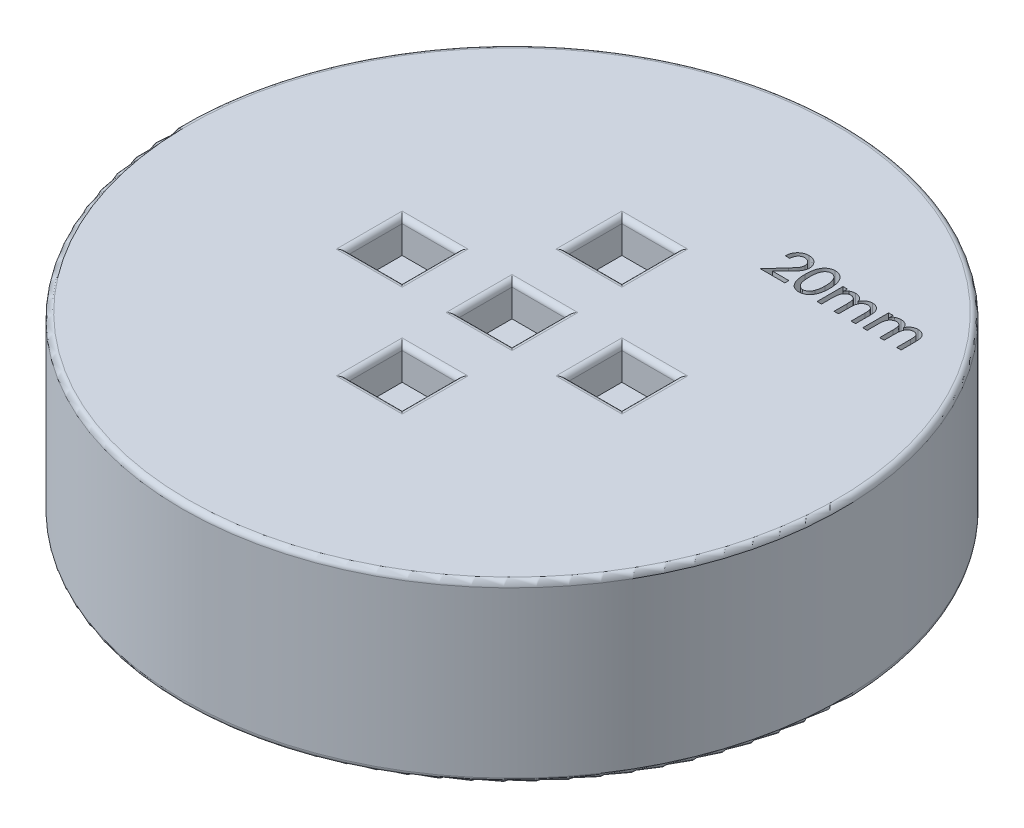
SolidWorks part; units mm, degrees
ref_plane "Front Plane" through (0, 0, 0) normal (0, 0, 1) x (1, 0, 0)
ref_plane "Top Plane" through (0, 0, 0) normal (0, 1, 0) x (1, 0, 0)
ref_plane "Right Plane" through (0, 0, 0) normal (1, 0, 0) x (0, 0, -1)
sketch "Sketch1" plane through (0, 0, 0) normal (0, 1, 0) x (1, 0, 0)
  circle A0 centre (0, 0) radius 30
extrude "Boss-Extrude1" add sketch "Sketch1" along normal blind 16
sketch "Sketch2" plane through (0, 16, 0) normal (0, 1, 0) x (1, 0, 0)
  line L0 (0, 0) -> (0, -10) construction
  line L1 (0, 0) -> (10, 0) construction
  line L2 (0, 0) -> (-10, 0) construction
  line L3 (0, 0) -> (0, 10) construction
  line L5 (-2.5, -7.5) -> (2.5, -7.5)
  line L6 (-2.5, -7.5) -> (-2.5, -12.5)
  line L7 (-2.5, -12.5) -> (2.5, -12.5)
  line L8 (2.5, -7.5) -> (2.5, -12.5)
  line L9 (-2.5, -7.5) -> (2.5, -12.5) construction
  line L10 (-2.5, -12.5) -> (2.5, -7.5) construction
  line L11 (-7.5, -2.5) -> (-12.5, -2.5)
  line L12 (-7.5, -2.5) -> (-7.5, 2.5)
  line L13 (-7.5, 2.5) -> (-12.5, 2.5)
  line L14 (-12.5, -2.5) -> (-12.5, 2.5)
  line L15 (-7.5, -2.5) -> (-12.5, 2.5) construction
  line L16 (-7.5, 2.5) -> (-12.5, -2.5) construction
  line L17 (2.5, -2.5) -> (-2.5, -2.5)
  line L18 (2.5, -2.5) -> (2.5, 2.5)
  line L19 (2.5, 2.5) -> (-2.5, 2.5)
  line L20 (-2.5, -2.5) -> (-2.5, 2.5)
  line L21 (2.5, -2.5) -> (-2.5, 2.5) construction
  line L22 (2.5, 2.5) -> (-2.5, -2.5) construction
  line L23 (-2.5, 12.5) -> (2.5, 12.5)
  line L24 (-2.5, 12.5) -> (-2.5, 7.5)
  line L25 (-2.5, 7.5) -> (2.5, 7.5)
  line L26 (2.5, 12.5) -> (2.5, 7.5)
  line L27 (-2.5, 12.5) -> (2.5, 7.5) construction
  line L28 (-2.5, 7.5) -> (2.5, 12.5) construction
  line L29 (12.5, -2.5) -> (7.5, -2.5)
  line L30 (12.5, -2.5) -> (12.5, 2.5)
  line L31 (12.5, 2.5) -> (7.5, 2.5)
  line L32 (7.5, -2.5) -> (7.5, 2.5)
  line L33 (12.5, -2.5) -> (7.5, 2.5) construction
  line L34 (12.5, 2.5) -> (7.5, -2.5) construction
  dimension "D1" = 5
  dimension "D2" = 10
  dimension "D3" = 5
  dimension "D4" = 5
  dimension "D5" = 5
  dimension "D6" = 5
  dimension "D7" = 5
  dimension "D8" = 5
extrude "Cut-Extrude1" cut sketch "Sketch2" against normal blind 3
fillet "Fillet1" radius 0.5 6 edges at (2.5, 16, 0) (0, 16, 2.5) (-12.5, 16, 0) (-10, 16, 2.5) (-7.5, 16, 0) (-10, 16, -2.5)
sketch "Sketch3" plane through (0, 16, 0) normal (0, 1, 0) x (1, 0, 0)
sketch "Sketch4" plane through (0, 0, 0) normal (0, -1, 0) x (-1, 0, 0)
  line L0 (0, 0) -> (-10, 0) construction
  line L1 (0, 0) -> (0, -10) construction
  line L2 (0, 0) -> (0, 10) construction
  line L3 (0, 0) -> (10, 0) construction
  line L5 (-2.5, 2.5) -> (2.5, 2.5)
  line L6 (-2.5, 2.5) -> (-2.5, -2.5)
  line L7 (-2.5, -2.5) -> (2.5, -2.5)
  line L8 (2.5, 2.5) -> (2.5, -2.5)
  line L9 (-2.5, 2.5) -> (2.5, -2.5) construction
  line L10 (-2.5, -2.5) -> (2.5, 2.5) construction
  line L11 (-2.5, -7.5) -> (2.5, -7.5)
  line L12 (-2.5, -7.5) -> (-2.5, -12.5)
  line L13 (-2.5, -12.5) -> (2.5, -12.5)
  line L14 (2.5, -7.5) -> (2.5, -12.5)
  line L15 (-2.5, -7.5) -> (2.5, -12.5) construction
  line L16 (-2.5, -12.5) -> (2.5, -7.5) construction
  line L17 (7.5, 2.5) -> (12.5, 2.5)
  line L18 (7.5, 2.5) -> (7.5, -2.5)
  line L19 (7.5, -2.5) -> (12.5, -2.5)
  line L20 (12.5, 2.5) -> (12.5, -2.5)
  line L21 (7.5, 2.5) -> (12.5, -2.5) construction
  line L22 (7.5, -2.5) -> (12.5, 2.5) construction
  line L23 (-12.5, 2.5) -> (-7.5, 2.5)
  line L24 (-12.5, 2.5) -> (-12.5, -2.5)
  line L25 (-12.5, -2.5) -> (-7.5, -2.5)
  line L26 (-7.5, 2.5) -> (-7.5, -2.5)
  line L27 (-12.5, 2.5) -> (-7.5, -2.5) construction
  line L28 (-12.5, -2.5) -> (-7.5, 2.5) construction
  line L29 (2.5, 7.5) -> (-2.5, 7.5)
  line L30 (2.5, 7.5) -> (2.5, 12.5)
  line L31 (2.5, 12.5) -> (-2.5, 12.5)
  line L32 (-2.5, 7.5) -> (-2.5, 12.5)
  line L33 (2.5, 7.5) -> (-2.5, 12.5) construction
  line L34 (2.5, 12.5) -> (-2.5, 7.5) construction
  dimension "D1" = 5
  dimension "D2" = 5
  dimension "D3" = 5
  dimension "D4" = 5
  dimension "D5" = 5
  dimension "D6" = 5
extrude "Cut-Extrude2" cut sketch "Sketch4" against normal blind 3
fillet "Fillet2" radius 0.5 21 edges at (0, 0, 30) (2.5, 0, 0) (0, 0, 2.5) (-2.5, 0, 0) (0, 0, -2.5) (2.5, 0, 10) (0, 0, 12.5) (-2.5, 0, 10) (0, 0, 7.5) (-7.5, 0, 0) (-10, 0, 2.5) (-12.5, 0, 0) (-10, 0, -2.5) (12.5, 0, 0) (10, 0, 2.5) (7.5, 0, 0) (10, 0, -2.5) (-2.5, 0, -10) (0, 0, -12.5) (2.5, 0, -10) (0, 0, -7.5)
fillet "Fillet3" radius 0.5 15 edges at (0, 16, 30) (0, 16, 7.5) (-2.5, 16, 10) (0, 16, 12.5) (2.5, 16, 10) (-2.5, 16, 0.25) (0.25, 16, -2.5) (0, 16, -12.5) (-2.5, 16, -10) (0, 16, -7.5) (2.5, 16, -10) (10, 16, 2.5) (12.5, 16, 0) (10, 16, -2.5) (7.5, 16, 0)
sketch "Sketch5" plane through (0, 16, 0) normal (0, 1, 0) x (1, 0, 0)
  text T0 "<b>20mm</b>"
extrude "Cut-Extrude3" cut sketch "Sketch5" against normal blind 2
